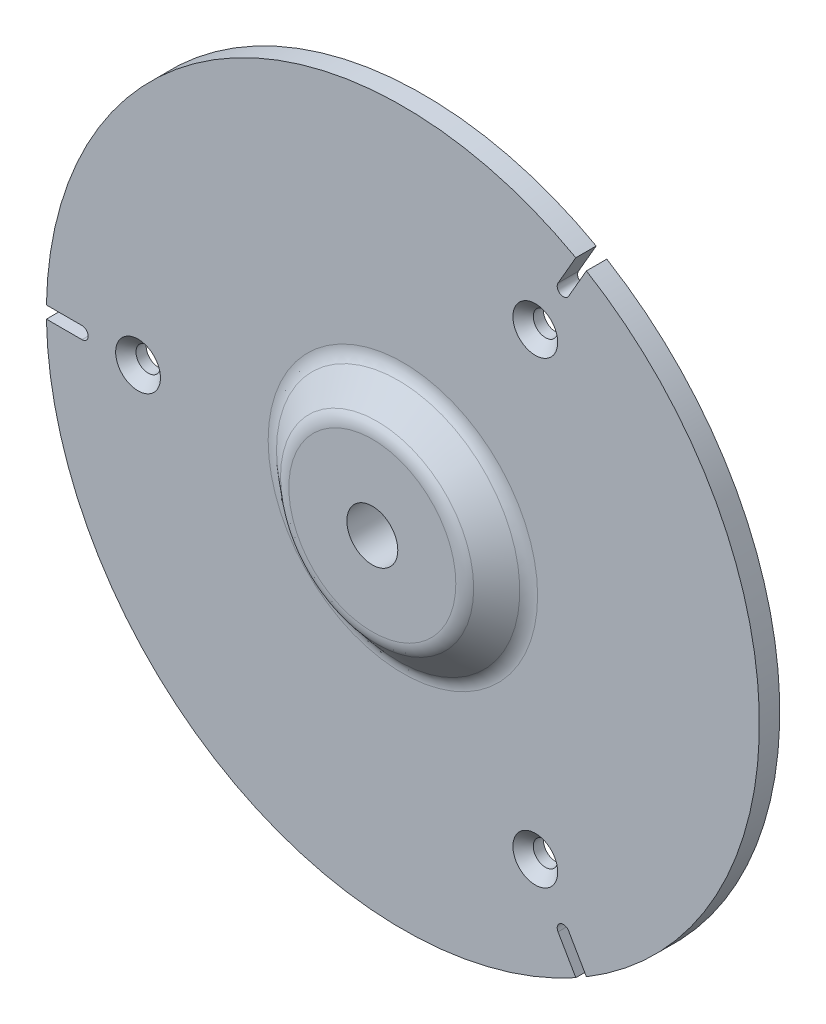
SolidWorks part; units mm, degrees
ref_plane "Plan de face" through (0, 0, 0) normal (0, 0, 1) x (1, 0, 0)
ref_plane "Plan de dessus" through (0, 0, 0) normal (0, 1, 0) x (1, 0, 0)
ref_plane "Plan de droite" through (0, 0, 0) normal (1, 0, 0) x (0, 0, -1)
sketch "Esquisse1" plane through (0, 0, 0) normal (0, 0, 1) x (1, 0, 0)
  circle A0 centre (0, 0) radius 35
  arc A1 (34.641, 5) -> (18.017, 30.0064) centre (0, 0) ccw construction
extrude "Extrusion1" add sketch "Esquisse1" along normal up to surface (2 mm away)
sketch "Esquisse2" plane through (0, 0, 2) normal (0, 0, 1) x (1, 0, 0)
  circle A0 centre (0, 0) radius 12.5
  dimension "D1" = 25
extrude "Extrusion2" add sketch "Esquisse2" along normal blind 3 draft 50
fillet "Congé1" radius 2 2 edges at (8.9247, 0, 5) (-12.5, 0, 2)
hole_wizard "Trou taraudé M61" positions "Esquisse4" profile "Esquisse3" tap size "M6" standard "ISO"
sketch "Esquisse4" plane through (0, 0, 5) normal (0, 0, 1) x (1, 0, 0)
  circle A0 centre (0, 0) radius 8.1968 construction
  point P0 (0, 0)
sketch "Esquisse3" plane through (0, 0, 5) normal (1, 0, 0) x (0, -1, 0)
  line L0 (0, 0) -> (0, 5)
  line L1 (0, 5) -> (2.5, 5)
  line L2 (2.5, 5) -> (2.5, 0)
  line L5 (2.5, 0) -> (0, 0)
  line L11 (0, -6.35) -> (0, 107.95) construction
  dimension "Diamètre du trou pour taraudage jusqu'au prochain" = 5
  dimension "Profondeur du trou pour taraudage jusqu'au prochain" = 5
sketch "Esquisse5" plane through (0, 0, 2) normal (0, 0, 1) x (1, 0, 0)
  line L0 (-34.9949, 0.6) -> (-32, 0.6) construction
  line L1 (-34.9949, 0.6) -> (-31.5, 0.6)
  line L2 (-34.9949, -0.6) -> (-32, -0.6) construction
  line L3 (-34.9949, -0.6) -> (-31.5, -0.6)
  line L4 (-32, 0.6) -> (-32, -0.6) construction
  arc A0 (-31.5, 0.6) -> (-31.5, -0.6) centre (-31.5, 0) cw
  circle A1 centre (0, 0) radius 35 construction
  arc A2 (-34.9949, 0.6) -> (-34.9949, -0.6) centre (0, 0) ccw
  dimension "D1" = 0.5
extrude "Enlèv. mat.-Extru.1" cut sketch "Esquisse5" against normal up to next
hole_wizard "Fraisage pour vis à tête fraisée M21" positions "Esquisse7" profile "Esquisse6" countersink size "M2" standard "Ansi Métrique"
sketch "Esquisse7" plane through (0, 0, 2) normal (0, 0, 1) x (1, 0, 0)
  circle A0 centre (-26, 0) radius 0.85 construction
  point P0 (-26, 0)
sketch "Esquisse6" plane through (-26, 0, 2) normal (1, 0, 0) x (0, -1, 0)
  line L0 (0, 0) -> (0, 2)
  line L1 (0, 2) -> (1.2, 2)
  line L2 (1.2, 2) -> (1.2, 1)
  line L3 (1.2, 1) -> (2.2, 0)
  line L5 (2.2, 0) -> (0, 0)
  line L6 (-1.2, 1) -> (-2.2, 0) construction
  line L11 (0, -6.35) -> (0, 107.95) construction
  dimension "Diamètre du perçage jusqu'au prochain" = 2.4
  dimension "Profondeur du perçage jusqu'au prochain" = 2
  dimension "Diamètre du fraisage entrant" = 4.4
  dimension "Angle du fraisage entrant" = 90
pattern_circular "Répétition circulaire1" count 3 over 360 about axis through (0, 0, 0) along (0, 0, 1) of "Enlèv. mat.-Extru.1", "Fraisage pour vis à tête fraisée M21"
